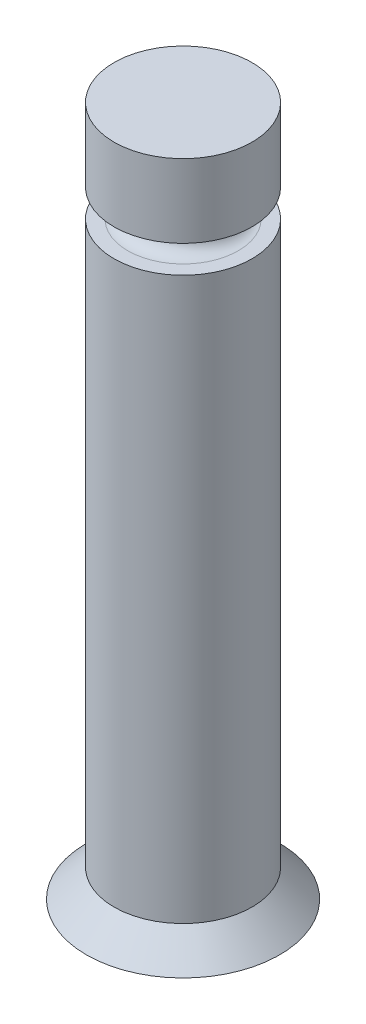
SolidWorks part; units mm, degrees
ref_plane "Front Plane" through (0, 0, 0) normal (0, 0, 1) x (1, 0, 0)
ref_plane "Top Plane" through (0, 0, 0) normal (0, 1, 0) x (1, 0, 0)
ref_plane "Right Plane" through (0, 0, 0) normal (1, 0, 0) x (0, 0, -1)
sketch "Sketch1" plane through (0, 0, 0) normal (0, 0, 1) x (1, 0, 0)
  line L0 (0, 0) -> (-5, 0)
  line L1 (-5, 0) -> (-5, -5.3163)
  line L2 (-5, -48) -> (-7, -50)
  line L3 (-7, -50) -> (0, -50)
  line L4 (0, 0) -> (0, -46.031) construction
  line L5 (0, 0) -> (0, -50)
  line L6 (-5, -5.3163) -> (-4, -5.3163)
  line L7 (-4, -7.3163) -> (-5, -7.3163)
  line L8 (-5, -7.3163) -> (-5, -48)
  arc A0 (-4, -5.3163) -> (-4, -7.3163) centre (-4, -6.3163) cw
  dimension "D5" = 1
  dimension "D1" = 50
  dimension "D2" = 45
  dimension "D3" = 2
  dimension "D4" = 5
  dimension "D6" = 1
revolve "Revolve1" add sketch "Sketch1" angle 360 about L4
